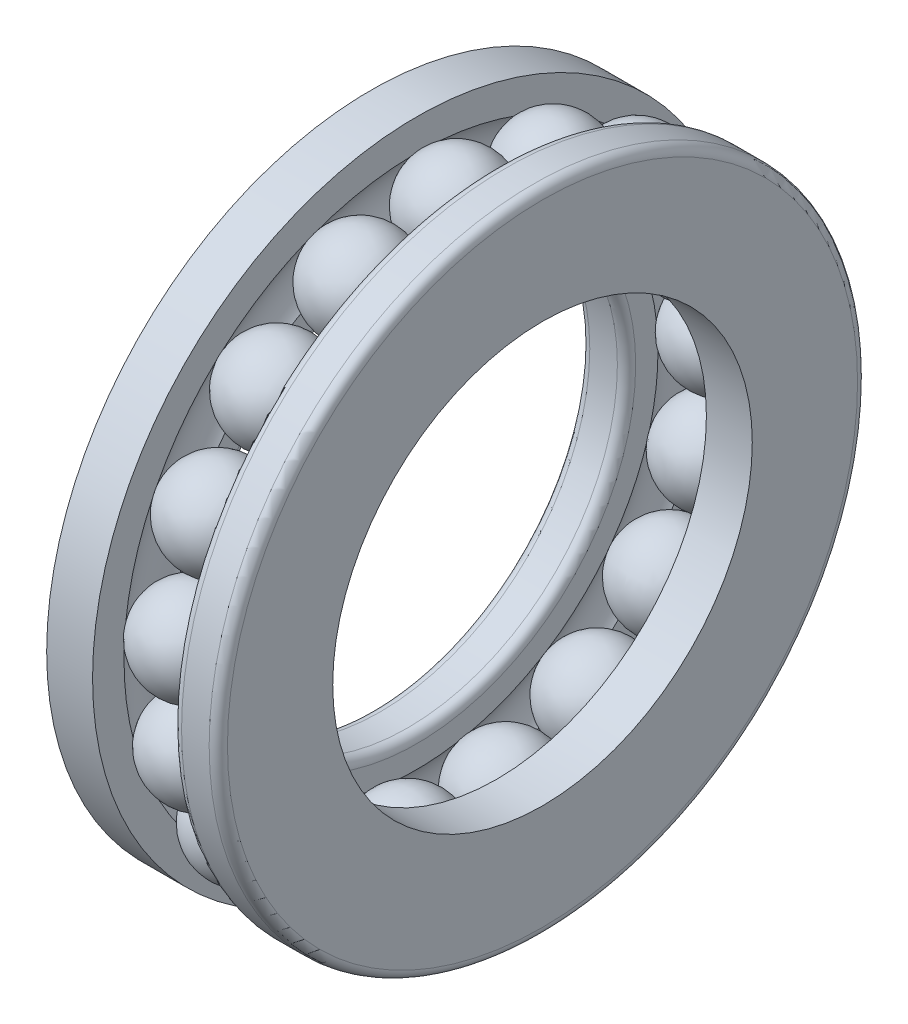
SolidWorks part; units mm, degrees
ref_plane "Plane1" through (0, 0, 0) normal (0, 0, 1) x (1, 0, 0)
ref_plane "Plane2" through (0, 0, 0) normal (0, 1, 0) x (1, 0, 0)
ref_plane "Plane3" through (0, 0, 0) normal (1, 0, 0) x (0, 0, -1)
other "Configuration Table"
sketch "Clipboard" plane through (0, 0, 0) normal (0, 0, 1) x (1, 0, 0)
  line L0 (-10, 0) -> (10, 0) construction
  line L1 (0, 0) -> (21.3836, -6.5376)
  line L2 (0, 0) -> (27.3662, 35.0271)
  line L3 (0, 0) -> (13.7666, -17.6205)
  line L4 (0, 0) -> (-22.3471, -0.7804)
sketch "InnRacSke" plane through (0, 0, 0) normal (0, 0, 1) x (1, 0, 0)
  line L0 (-6.6469, 40.1581) -> (-6.6469, 34.925)
  line L1 (-6.6469, 34.925) -> (-14.2875, 34.925)
  line L2 (-14.2875, 34.925) -> (-14.2875, 53.975)
  line L3 (-14.2875, 53.975) -> (-6.6469, 53.975)
  line L4 (-6.6469, 53.975) -> (-6.6469, 48.7419)
  line L5 (-34.9219, 0) -> (34.9219, 0) construction
  line L6 (0, 0) -> (0, 25.4) construction
  arc A2 (-6.6469, 48.7419) -> (-6.6469, 40.1581) centre (0, 44.45) ccw
revolve "Race" add sketch "InnRacSke" angle 360 about L5
ref_axis "Axis1" through (-50, 0, 0) along (1, 0, 0)
sketch "BalDetSke" plane through (0, 0, 0) normal (0, 0, 1) x (1, 0, 0)
  line L0 (-7.9375, 44.45) -> (7.9375, 44.45)
  line L1 (-14.5732, 44.45) -> (14.5732, 44.45) construction
  arc A0 (7.9375, 44.45) -> (-7.9375, 44.45) centre (0, 44.45) cw
revolve "BallDetailed" add sketch "BalDetSke" angle 360 about L1
sketch "BalSimSke" plane through (0, 0, 0) normal (0, 0, 1) x (1, 0, 0)
  line L0 (-25.4, 0) -> (25.4, 0) construction
  circle A0 centre (0, 44.45) radius 7.9375
revolve "BallsSimplified" [suppressed] add sketch "BalSimSke" angle 360 about L0
mirror "Mirror1" about plane through (0, 0, 0) normal (1, 0, 0) of "Race"
fillet "Fillet" radius 1.524 4 edges at (6.6469, 0, -53.975) (14.2875, 0, -53.975) (-6.6469, 0, -34.925) (-14.2875, 0, -34.925)
pattern_circular "BallsDetailed" count 17 every 21.176 about axis through (-50, 0, 0) along (1, 0, 0) of "BallDetailed"
sketch "CagSpiSke" plane through (0, 0, 0) normal (0, 0, 1) x (1, 0, 0)
  line L0 (1.9844, 35.7188) -> (1.9844, 53.1812)
  line L1 (1.9844, 53.1812) -> (-1.9844, 53.1812)
  line L2 (-1.9844, 35.7188) -> (-1.9844, 53.1812)
  line L3 (-1.9844, 35.7188) -> (1.9844, 35.7188)
  line L4 (-34.925, 0) -> (34.925, 0) construction
  line L5 (0, 0) -> (0, 76.2) construction
revolve "CageSpine" [suppressed] add sketch "CagSpiSke" angle 360 about L4
equation "\"BallCLRad@Clipboard\" =  ( \"OD@InnRacSke\" + \"ID@InnRacSke\" )  / 4"
equation "\"BallCLRad@BalSimSke\" = \"BallCLRad@Clipboard\""
equation "\"BallCLRad@BalDetSke\" = \"BallCLRad@Clipboard\""
equation "\"BallCLRad@InnRacSke\" = \"BallCLRad@Clipboard\""
equation "\"Ball_diameter@InnRacSke\" = \"Ball_diameter@BalDetSke\" - 0.002"
equation "\"Ball_diameter@BalSimSke\" = \"Ball_diameter@BalDetSke\""
equation "\"Max_count@Clipboard\" = int( 3.14159265 / atn(( \"Ball_diameter@BalDetSke\" / 2) / sqr( \"BallCLRad@Clipboard\"  *  \"BallCLRad@Clipboard\" - ( \"Ball_diameter@BalDetSke\" / 2) *  ( \"Ball_diameter@BalDetSke\" "
equation "\"Max_count@Clipboard\" = ((sgn( \"Max_count@Clipboard\" - \"Count@Clipboard\" )-1)*( \"Max_count@Clipboard\" - \"Count@Clipboard\" ))/-2+ \"Count@Clipboard\""
equation "\"Count@BallsDetailed\" = int( \"Show_count@Clipboard\" ) "
equation "\"Count@BallsDetailed\" = ((sgn( \"Count@BallsDetailed\" - \"Max_count@Clipboard\" )-1)*( \"Count@BallsDetailed\" - \"Max_count@Clipboard\" ))/-2+ \"Max_count@Clipboard\""
equation "\"Count@BallsDetailed\" = ((sgn( \"Count@BallsDetailed\" - \"Min_count@Clipboard\" )+1)*( \"Count@BallsDetailed\" - \"Min_count@Clipboard\"))/2 +\"Min_count@Clipboard\""
equation "\"Angle@BallsDetailed\" = 360.0 / \"Max_count@Clipboard\""
equation "\"Angle@CageSpine\" =  \"Angle@BallsDetailed\" * ( \"Count@BallsDetailed\" -1 + int( \"Count@BallsDetailed\" / \"Max_count@Clipboard\" ) )  + 0.001 -  int( \"Count@BallsDetailed\" / \"Max_count@Clipboard\" ) * 0.00"
equation "\"Angle@CageSpine\" =  \"Angle@CageSpine\" * int( \"Min_count@Clipboard\" / 2) + int(1 / \"Min_count@Clipboard\")  * 0.001"
equation "\"Thickness@CagSpiSke\" =  \"Ball_diameter@BalDetSke\" * 0.25"
equation "\"OD@CagSpiSke\" = ( \"OD@InnRacSke\" + ( \"BallCLRad@Clipboard\" * 2 + \"Ball_diameter@BalDetSke\" )) / 2"
equation "\"ID@CagSpiSke\" = ( \"ID@InnRacSke\" + ( \"BallCLRad@Clipboard\" * 2 - \"Ball_diameter@BalDetSke\" )) / 2"
